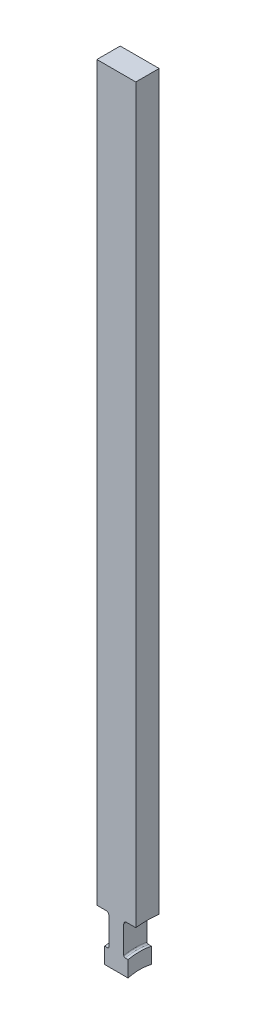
SolidWorks part; units mm, degrees
ref_plane "Front Plane" through (0, 0, 0) normal (0, 0, 1) x (1, 0, 0)
ref_plane "Top Plane" through (0, 0, 0) normal (0, 1, 0) x (1, 0, 0)
ref_plane "Right Plane" through (0, 0, 0) normal (1, 0, 0) x (0, 0, -1)
sketch "Sketch1" plane through (0, 0, 0) normal (1, 0, 0) x (0, 0, -1)
  line L0 (-3, 212) -> (-3, 0)
  line L1 (0, 249.2329) -> (0, 0) construction
  line L2 (3, 212) -> (3, 0)
  line L3 (-3, 212) -> (3, 212)
  line L6 (-3, 0) -> (3, 0)
  arc A0 (-12, 0) -> (12, 0) centre (0, 0) cw construction
  dimension "R" = 12
  dimension "L" = 200
  dimension "T" = 6
extrude "Boss-Extrude1" add sketch "Sketch1" along normal mid plane 10
sketch "Sketch8" plane through (0, 0, 0) normal (1, 0, 0) x (0, 0, -1)
  circle A0 centre (0, 0) radius 12
  arc A1 (12, 0) -> (-12, 0) centre (0, 0) ccw construction
extrude "Cut-Extrude4" cut sketch "Sketch8" against normal through all both and the other way through all
sketch "Sketch2" plane through (0, 0, 0) normal (0, 0, 1) x (1, 0, 0)
  line L0 (5, 16) -> (1.905, 16)
  line L1 (5, 212) -> (5, 11.619) construction
  line L2 (1.905, 16) -> (1.905, 24)
  line L3 (1.905, 24) -> (5, 24)
  line L4 (5, 24) -> (5, 16)
  line L5 (0, 29.9173) -> (0, 0) construction
  line L6 (-5, 24) -> (-5, 16)
  line L7 (-1.905, 24) -> (-5, 24)
  line L8 (-1.905, 16) -> (-1.905, 24)
  line L9 (-5, 16) -> (-1.905, 16)
  line L10 (-8.8482, 0) -> (24.5305, 0) construction
  dimension "D1" = 3.81
  dimension "D2" = 24
  dimension "D3" = 16
revolve "Cut-Revolve1" cut sketch "Sketch2" angle 360 about L10
sketch "Sketch7" plane through (0, 0, 0) normal (0, 0, 1) x (1, 0, 0)
  line L6 (-5, 16) -> (-3, 16)
  line L8 (-5, 16) -> (-5, 0)
  line L9 (-5, 0) -> (-3, 0)
  line L10 (-3, 16) -> (-3, 0)
  line L11 (0, 16.5651) -> (0, 5.9342) construction
  line L12 (3, 16) -> (3, 0)
  line L13 (5, 0) -> (3, 0)
  line L14 (5, 16) -> (5, 0)
  line L15 (5, 16) -> (3, 16)
  dimension "MW" = 6
extrude "Cut-Extrude3" cut sketch "Sketch7" against normal through all both and the other way through all
fillet "Fillet1" radius 0.762 2 edges at (-1.905, 24, 0) (1.905, 24, 0)
fillet "Fillet2" radius 0.381 2 edges at (-1.905, 16, 0) (1.905, 16, 0)
